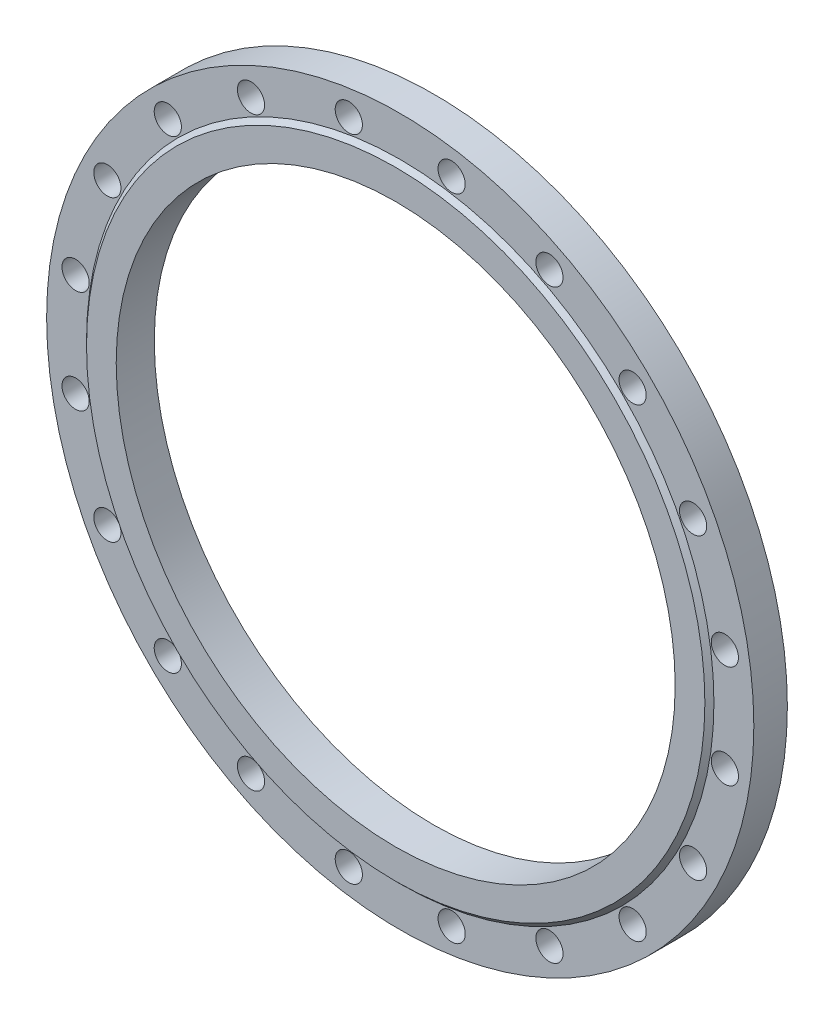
SolidWorks part; units mm, degrees
ref_plane "Plan de face" through (0, 0, 0) normal (0, 0, 1) x (1, 0, 0)
ref_plane "Plan de dessus" through (0, 0, 0) normal (0, 1, 0) x (1, 0, 0)
ref_plane "Plan de droite" through (0, 0, 0) normal (1, 0, 0) x (0, 0, -1)
sketch "Esquisse3" plane through (0, 0, 0) normal (1, 0, 0) x (0, 0, -1)
  line L0 (0, 0) -> (-318.7143, 0) construction
  line L1 (-24, 390) -> (13, 390)
  line L2 (-29, 341) -> (-29, 308.25)
  line L3 (-29, 308.25) -> (13, 308.25)
  line L4 (13, 390) -> (13, 308.25)
  line L5 (-29, 341) -> (-24, 346)
  line L6 (-24, 346) -> (-24, 390)
  dimension "D1" = 616.5
  dimension "D2" = 780
  dimension "D3" = 42
  dimension "D4" = 682
  dimension "D5" = 5
  dimension "D6" = 5
  dimension "D7" = 13
revolve "Révolution1" add sketch "Esquisse3" angle 360 about L0
sketch "Esquisse4" plane through (0, 0, 24) normal (0, 0, 1) x (1, 0, 0)
  line L0 (358.037, 56.7075) -> (0, 0) construction
  line L1 (0, 0) -> (390, 0) construction
  circle A0 centre (358.037, 56.7075) radius 15
  circle A1 centre (0, 0) radius 390 construction
  circle A2 centre (358.037, -56.7075) radius 15
  circle A3 centre (322.9899, -164.5716) radius 15
  circle A4 centre (256.3262, -256.3262) radius 15
  circle A5 centre (164.5716, -322.9899) radius 15
  circle A6 centre (56.7075, -358.037) radius 15
  circle A7 centre (-56.7075, -358.037) radius 15
  circle A8 centre (-164.5716, -322.9899) radius 15
  circle A9 centre (-256.3262, -256.3262) radius 15
  circle A10 centre (-322.9899, -164.5716) radius 15
  circle A11 centre (-358.037, -56.7075) radius 15
  circle A12 centre (-358.037, 56.7075) radius 15
  circle A13 centre (-322.9899, 164.5716) radius 15
  circle A14 centre (-256.3262, 256.3262) radius 15
  circle A15 centre (-164.5716, 322.9899) radius 15
  circle A16 centre (-56.7075, 358.037) radius 15
  circle A17 centre (56.7075, 358.037) radius 15
  circle A18 centre (164.5716, 322.9899) radius 15
  circle A19 centre (256.3262, 256.3262) radius 15
  circle A20 centre (322.9899, 164.5716) radius 15
  dimension "D2" = 30
  dimension "D1" = 9
  dimension "D3" = 362.5
extrude "Enlèv. mat.-Extru.1" cut sketch "Esquisse4" against normal through all
